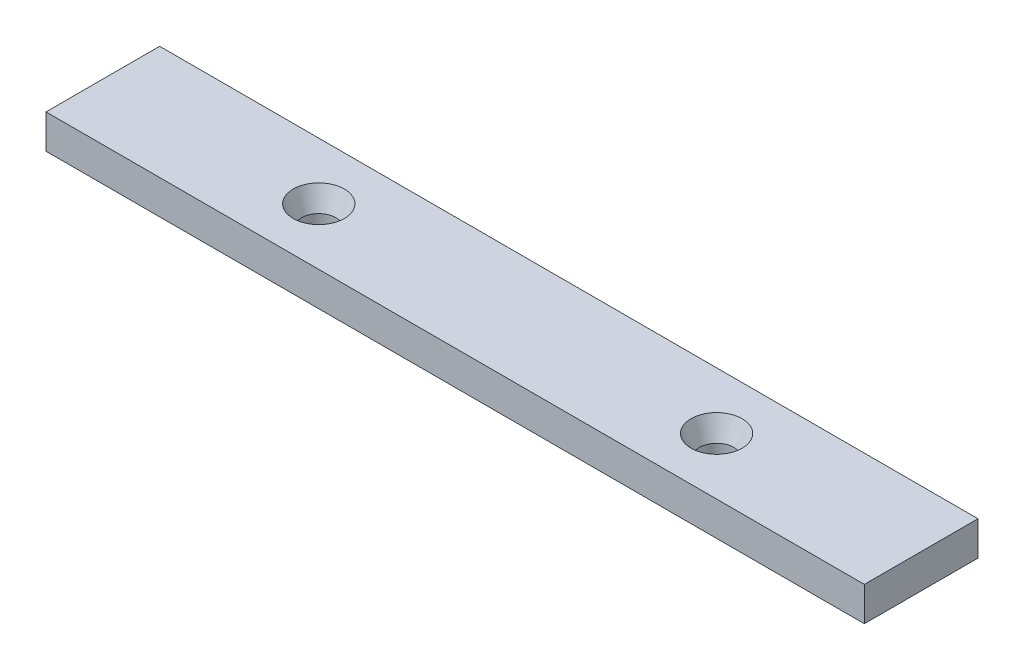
SolidWorks part; units mm, degrees
ref_plane "Front Plane" through (0, 0, 0) normal (0, 0, 1) x (1, 0, 0)
ref_plane "Top Plane" through (0, 0, 0) normal (0, 1, 0) x (1, 0, 0)
ref_plane "Right Plane" through (0, 0, 0) normal (1, 0, 0) x (0, 0, -1)
sketch "Sketch1" plane through (0, 0, 0) normal (0, 1, 0) x (1, 0, 0)
  line L1 (-72, -10) -> (72, -10)
  line L2 (-72, -10) -> (-72, 10)
  line L3 (-72, 10) -> (72, 10)
  line L4 (72, -10) -> (72, 10)
  line L5 (-72, -10) -> (72, 10) construction
  line L6 (-72, 10) -> (72, -10) construction
  point P0 (0, 0)
  dimension "D1" = 144
  dimension "D2" = 20
extrude "Extrude1" add sketch "Sketch1" along normal blind 6
hole_wizard "CSK for M6 Flat Head Machine Screw1" positions "3DSketch1" profile "Sketch3" countersink size "M6" standard "Ansi Metric"
sketch3d "3DSketch1"
  line L0 (72, 6, -10) -> (-72, 6, -10) construction
  line L1 (-72, 6, -10) -> (-72, 6, 10) construction
  point P0 (-34, 6, 0)
  dimension "D1" = 10
  dimension "D2" = 38
sketch "Sketch3" plane through (-34, 6, 0) normal (1, 0, 0) x (0, 0, 1)
  line L0 (0, 0) -> (0, 6)
  line L1 (0, 6) -> (3, 6)
  line L2 (3, 6) -> (3, 3.6213)
  line L3 (3, 3.6213) -> (4.5, 0)
  line L5 (4.5, 0) -> (0, 0)
  line L6 (-3, 3.6213) -> (-4.5, 0) construction
  line L11 (0, -6.35) -> (0, 107.95) construction
  dimension "Thru Hole Dia." = 6
  dimension "Thru Hole Depth" = 6
  dimension "Near C'Sink Dia." = 9
  dimension "Near C'Sink Angle" = 45
pattern_linear "LPattern2" count 2 spacing 70 along (1, 0, 0) of "CSK for M6 Flat Head Machine Screw1"
